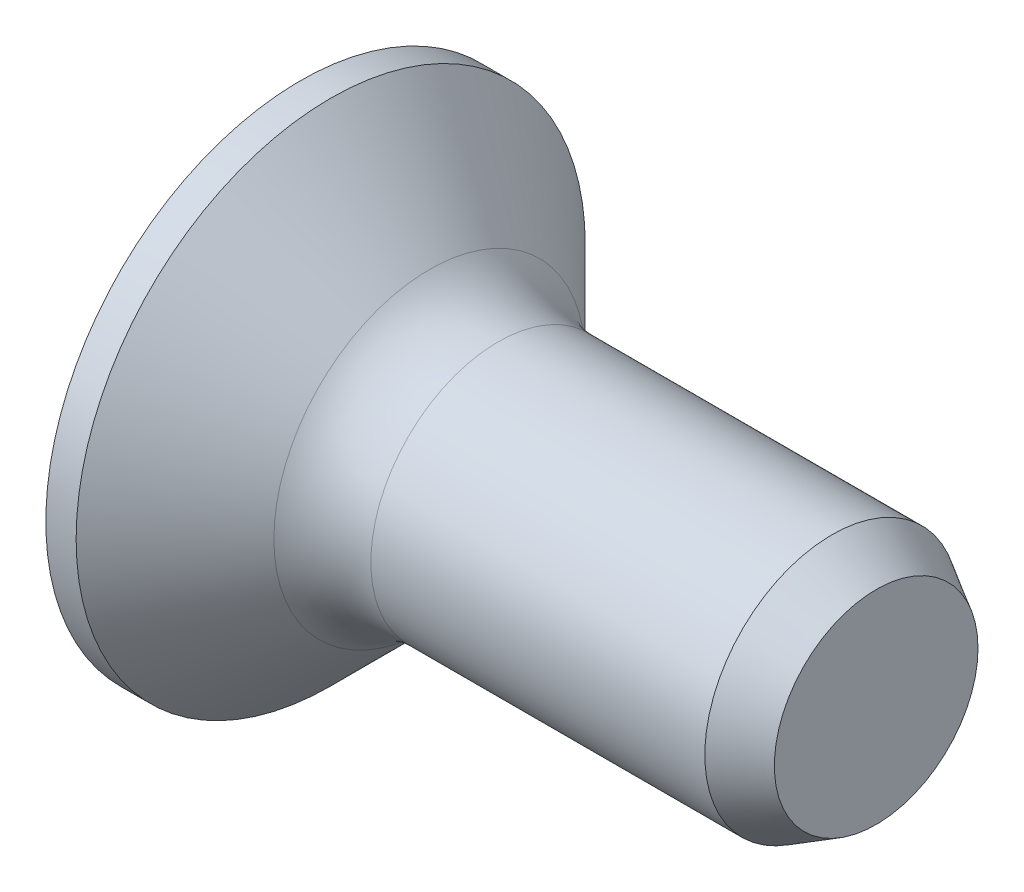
SolidWorks part; units mm, degrees
ref_plane "Front" through (0, 0, 0) normal (0, 0, 1) x (1, 0, 0)
ref_plane "Top" through (0, 0, 0) normal (0, 1, 0) x (1, 0, 0)
ref_plane "Right" through (0, 0, 0) normal (1, 0, 0) x (0, 0, -1)
sketch "Sketch1" plane through (0, 0, 0) normal (0, 0, 1) x (1, 0, 0)
  line L0 (0, 4.2) -> (0.5, 4.2)
  line L1 (0.5, 4.2) -> (2.6, 2.1)
  line L2 (2.6, 2.1) -> (9.5, 2.1)
  line L3 (9.5, 2.1) -> (9.5, 0)
  line L4 (9.5, 0) -> (0, 0)
  line L5 (0, 0) -> (0, 4.2)
  line L6 (6.6207, 0) -> (-0.9387, 0) construction
revolve "Revolve1" add sketch "Sketch1" angle 360 about L6
chamfer "Chamfer1" distance 0.42 angle 60 1 edges at (9.5, 0, -2.1)
sketch "Sketch9" plane through (0, 0, 0) normal (0, 0, 1) x (1, 0, 0)
  line L0 (3.8513, 1.6) -> (3.0287, 1.6)
  line L1 (3.0287, 1.6) -> (2.74, 2.1)
  line L2 (3.8513, 1.6) -> (4.14, 2.1)
  line L3 (2.74, 2.1) -> (2.74, 2.35)
  line L4 (4.14, 2.1) -> (4.14, 2.35)
  line L5 (2.74, 2.35) -> (4.14, 2.35)
  line L6 (3.44, 1.6) -> (3.44, 0) construction
  line L7 (0, 0) -> (7.3035, 0) construction
  line L8 (2.6, 2.1) -> (2.6, -2.1) construction
  line L9 (8.7725, 2.1) -> (2.6, 2.1) construction
revolve "ThreadSchematic" [suppressed] cut sketch "Sketch9" angle 360 about L7
pattern_linear "ThdSchPat" [suppressed] count 5 spacing 1.4 along (-1, 0, 0)
sketch "Sketch3" plane through (0, 0, 0) normal (0, 0, 1) x (1, 0, 0)
  line L0 (2.6, 2.1) -> (9.5, 2.1) construction
  line L2 (5.8, 2.1) -> (6.725, 2.1) construction
  line L3 (9.5, 2.1) -> (9.5, 0) construction
  line L4 (6.725, 2.1) -> (9.5, 2.1)
  line L5 (2.9, 0) -> (5.4301, 0) construction
  line L6 (9.5, 0) -> (9.7, 0)
  line L7 (9.7, 0) -> (9.7, 2.1)
  line L8 (9.7, 2.1) -> (9.5, 2.1)
  line L9 (6.725, 2.1) -> (9.5, 0)
revolve "EndCone" [suppressed] cut sketch "Sketch3" angle 360 about L5
sketch "Sketch4" plane through (0, 0, 0) normal (-1, 0, 0) x (0, 0, 1)
  line L0 (-0.575, 2.3) -> (-0.575, 0.575)
  line L1 (-0.575, 2.3) -> (0.575, 2.3)
  line L2 (-2.3, 0.575) -> (-2.3, -0.575)
  line L3 (-0.575, -2.3) -> (0.575, -2.3)
  line L4 (2.3, 0.575) -> (2.3, -0.575)
  line L5 (0.575, 2.3) -> (0.575, 0.575)
  line L6 (0.575, 0.575) -> (2.3, 0.575)
  line L7 (0.575, -0.575) -> (2.3, -0.575)
  line L8 (0.575, -0.575) -> (0.575, -2.3)
  line L9 (-0.575, -0.575) -> (-0.575, -2.3)
  line L10 (-0.575, -0.575) -> (-2.3, -0.575)
  line L11 (-0.575, 0.575) -> (-2.3, 0.575)
  line L12 (2.3, 0) -> (-2.3, 0) construction
extrude "Cut-Extrude1" cut sketch "Sketch4" against normal blind 2.1
draft "Draft1" type of draft neutral plane draft angle 35 faces to draft 4 parameters "D1"=35
draft "Draft2" type of draft neutral plane draft angle 8 faces to draft 8 parameters "D1"=8
sketch "Sketch6" plane through (2.1, 0, 0) normal (-1, 0, 0) x (0, 0, 1)
  line L0 (0.2799, 0.2799) -> (0.2799, 0.8296) construction
  line L1 (0.8296, 0.2799) -> (0.2799, 0.2799) construction
  line L2 (-0.2799, 0.8296) -> (-0.2799, 0.2799) construction
  line L3 (-0.2799, 0.2799) -> (-0.8296, 0.2799) construction
  line L4 (-0.8296, -0.2799) -> (-0.2799, -0.2799) construction
  line L5 (-0.2799, -0.2799) -> (-0.2799, -0.8296) construction
  line L6 (0.2799, -0.8296) -> (0.2799, -0.2799) construction
  line L7 (0.2799, -0.2799) -> (0.8296, -0.2799) construction
  line L9 (-0.5547, 0.2799) -> (-0.5547, -0.2799)
  line L10 (-0.2799, -0.5547) -> (0.2799, -0.5547)
  line L11 (0.5547, -0.2799) -> (0.5547, 0.2799)
  line L12 (0.2799, 0.5547) -> (-0.2799, 0.5547)
  arc A0 (0.2799, 0.5547) -> (0.5547, 0.2799) centre (0.5547, 0.5547) ccw
  arc A1 (-0.2799, 0.5547) -> (-0.5547, 0.2799) centre (-0.5547, 0.5547) cw
  arc A2 (-0.5547, -0.2799) -> (-0.2799, -0.5547) centre (-0.5547, -0.5547) cw
  arc A3 (0.2799, -0.5547) -> (0.5547, -0.2799) centre (0.5547, -0.5547) cw
sketch "Sketch7" plane through (0, 0, 0) normal (-1, 0, 0) x (0, 0, 1)
  line L8 (0.575, 0.575) -> (0.575, 2.3) construction
  line L9 (2.3, 0.575) -> (0.575, 0.575) construction
  line L10 (0.575, -0.575) -> (2.3, -0.575) construction
  line L11 (0.575, -2.3) -> (0.575, -0.575) construction
  line L12 (-0.575, 2.3) -> (-0.575, 0.575) construction
  line L13 (-0.575, 0.575) -> (-2.3, 0.575) construction
  line L14 (-2.3, -0.575) -> (-0.575, -0.575) construction
  line L15 (-0.575, -0.575) -> (-0.575, -2.3) construction
  line L16 (0.8498, 0.575) -> (0.8498, -0.575)
  line L17 (0.575, -0.8498) -> (-0.575, -0.8498)
  line L18 (-0.8498, -0.575) -> (-0.8498, 0.575)
  line L19 (-0.575, 0.8498) -> (0.575, 0.8498)
  arc A0 (0.575, 0.8498) -> (0.8498, 0.575) centre (0.8498, 0.8498) ccw
  arc A1 (-0.575, 0.8498) -> (-0.8498, 0.575) centre (-0.8498, 0.8498) cw
  arc A2 (-0.8498, -0.575) -> (-0.575, -0.8498) centre (-0.8498, -0.8498) cw
  arc A3 (0.2799, 0.5547) -> (0.5547, 0.2799) centre (0.5547, 0.5547) ccw construction
  arc A4 (0.8498, -0.575) -> (0.575, -0.8498) centre (0.8498, -0.8498) ccw
loft "Cut-Loft1" cut profiles "Sketch6", "Sketch7"
sketch "Sketch8" plane through (0, 0, 0) normal (-1, 0, 0) x (0, 0, 1)
  line L0 (0, 0) -> (2.3, 2.3) construction
  line L1 (0.2799, 0.5547) -> (2.3, 2.3)
  line L2 (2.3, 2.3) -> (0.5547, 0.2799)
  line L3 (0.575, 2.3) -> (2.3, 2.3) construction
  line L4 (2.3, 2.3) -> (2.3, 0.575) construction
  line L5 (0, 0) -> (0.5547, 0) construction
  line L6 (0.5547, 0.2799) -> (0.5547, 0)
  line L7 (0.2799, 0.5547) -> (0, 0.5547)
  line L8 (0, 0.5547) -> (0, 0) construction
  line L9 (0.2799, -0.5547) -> (0, -0.5547)
  line L10 (2.3, -2.3) -> (0.2799, -0.5547)
  line L11 (0.5547, -0.2799) -> (2.3, -2.3)
  line L12 (0.5547, -0.2799) -> (0.5547, 0)
  line L13 (-0.5547, -0.2799) -> (-0.5547, 0)
  line L14 (-2.3, -2.3) -> (-0.5547, -0.2799)
  line L15 (-0.2799, -0.5547) -> (-2.3, -2.3)
  line L16 (-0.2799, -0.5547) -> (0, -0.5547)
  line L17 (-0.2799, 0.5547) -> (0, 0.5547)
  line L18 (-2.3, 2.3) -> (-0.2799, 0.5547)
  line L19 (-0.5547, 0.2799) -> (-2.3, 2.3)
  line L20 (-0.5547, 0.2799) -> (-0.5547, 0)
  arc A1 (0.2799, 0.5547) -> (0.5547, 0.2799) centre (0.5547, 0.5547) ccw construction
  arc A2 (0.2799, 0.5547) -> (0.5547, 0.2799) centre (0.5547, 0.5547) ccw construction
extrude "TypeZ" [suppressed] cut sketch "Sketch8" against normal blind 0.42 draft 3
fillet "Fillet1" radius 1.6 1 edges at (2.6, 0, -2.1)
equation "\"D1@Chamfer1\" = \"d@Sketch1\" / 10"
equation "\"D1@Sketch4\" = \"m@Sketch4\" / 4"
equation "\"D1@TypeZ\" = \"p@Cut-Extrude1\"*0.2"
equation "\"D1@Sketch3\" = \"y@Sketch3\" / 4"
equation "\"threadstart@Sketch9\"=\"advance@Sketch9\"*0.6"
equation "\"D1@ThdSchPat\" = int(((\"l@Sketch1\"-\"k@Sketch1\")/\"advance@Sketch9\") + 0.8)"
equation "\"D3@ThdSchPat\" = \"advance@Sketch9\""
equation "\"minordia@Sketch9\" = \"D2@ThreadCosmetic\""
